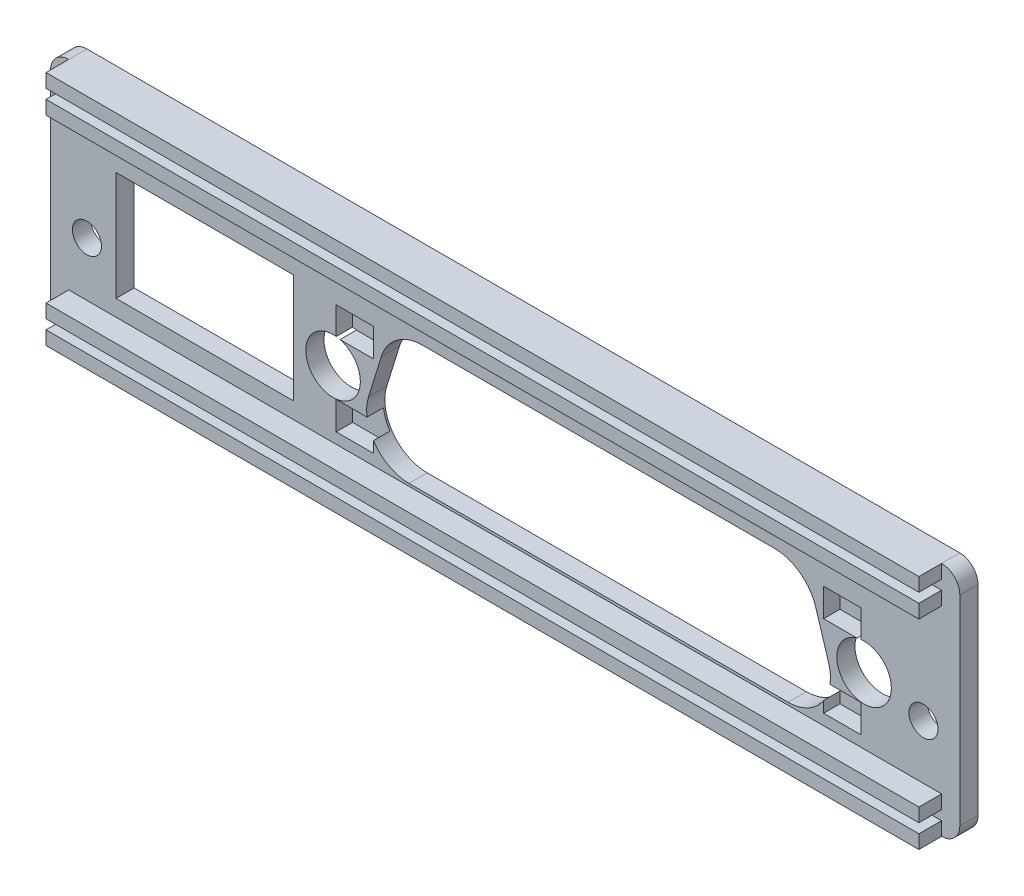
SolidWorks part; units mm, degrees
other "Markup1"
sketch "Sketch35" plane through (-52.5, 13, 44.5) normal (-0.6257, 0.1895, 0.7567) x (0.7782, 0.0858, 0.6221)
ref_plane "Front Plane" through (0, 0, 0) normal (0, 0, 1) x (1, 0, 0)
ref_plane "Top Plane" through (0, 0, 0) normal (0, 1, 0) x (1, 0, 0)
ref_plane "Right Plane" through (0, 0, 0) normal (1, 0, 0) x (0, 0, -1)
sketch "Sketch1" plane through (0, 0, 0) normal (0, 0, 1) x (1, 0, 0)
  line L1 (-56.25, -12.1) -> (56.25, -12.1)
  line L2 (-56.25, -12.1) -> (-56.25, 12.1)
  line L3 (-56.25, 12.1) -> (56.25, 12.1)
  line L4 (56.25, -12.1) -> (56.25, 12.1)
  line L5 (-56.25, -12.1) -> (56.25, 12.1) construction
  line L6 (-56.25, 12.1) -> (56.25, -12.1) construction
  point P0 (0, 0)
  dimension "D1" = 112.5
  dimension "D2" = 24.2
extrude "Boss-Extrude1" add sketch "Sketch1" along normal blind 4.5
sketch "Sketch2" plane through (0, 0, 4.5) normal (0, 0, 1) x (1, 0, 0)
  line L0 (35.0828, -2.7809) -> (33.6783, 1.7487) construction
  line L1 (29.619, 4.74) -> (-9.081, 4.74) construction
  line L2 (-10.581, -8.16) -> (31.119, -8.16) construction
  line L3 (-13.1403, 1.7487) -> (-14.5448, -2.7809) construction
  line L4 (35.0828, -2.7809) -> (33.6783, 1.7487) construction
  line L5 (29.619, 4.74) -> (-9.081, 4.74) construction
  line L6 (-10.581, -8.16) -> (31.119, -8.16) construction
  line L7 (-13.1403, 1.7487) -> (-14.5448, -2.7809) construction
  line L8 (35.5604, -2.6329) -> (34.1559, 1.8968)
  line L9 (29.619, 5.24) -> (-9.081, 5.24)
  line L10 (-13.6179, 1.8967) -> (-15.0224, -2.6329)
  line L11 (-10.581, -8.66) -> (31.119, -8.66)
  line L12 (-46.627, -7.16) -> (-24.123, -7.16) construction
  line L13 (-23.3, -7.16) -> (-42.8, -7.16)
  line L14 (-23.3, -7.16) -> (-23.3, 4.84)
  line L15 (-23.3, 4.84) -> (-42.8, 4.84)
  line L16 (-42.8, -7.16) -> (-42.8, 4.84)
  line L17 (-23.3, -7.16) -> (-42.8, 4.84) construction
  line L18 (-23.3, 4.84) -> (-42.8, -7.16) construction
  line L21 (-20.5706, -1.7692) -> (-10.531, -1.7692) construction
  line L22 (-46.5, 7.7015) -> (-46.5, 7.29) construction
  line L23 (-10.531, 0.44) -> (-10.531, -3.86) construction
  line L28 (-17.031, 5.89) -> (-8.531, 5.89) construction
  circle A0 centre (-18.931, -1.66) radius 3
  circle A1 centre (39.469, -1.66) radius 3
  spline S0 degree 3 poles (31.119, -8.16) (34.175, -8.16) (35.9879, -5.6998) (35.0828, -2.7809) knots 0 0 0 0 1 1 1 1 weights 1 0.72882 0.72882 1 construction
  spline S1 degree 3 poles (33.6783, 1.7487) (33.1062, 3.5939) (31.5509, 4.74) (29.619, 4.74) knots 0 0 0 0 1 1 1 1 weights 1 0.870022 0.870022 1 construction
  spline S2 degree 3 poles (-9.081, 4.74) (-11.0129, 4.74) (-12.5682, 3.5939) (-13.1403, 1.7487) knots 0 0 0 0 1 1 1 1 weights 1 0.870022 0.870022 1 construction
  spline S3 degree 3 poles (-14.5448, -2.7809) (-15.4499, -5.6998) (-13.637, -8.16) (-10.581, -8.16) knots 0 0 0 0 1 1 1 1 weights 1 0.72882 0.72882 1 construction
  spline S4 degree 3 poles (31.119, -8.16) (34.175, -8.16) (35.9879, -5.6998) (35.0828, -2.7809) knots 0 0 0 0 1 1 1 1 weights 1 0.72882 0.72882 1 construction
  spline S5 degree 3 poles (33.6783, 1.7487) (33.1062, 3.5939) (31.5509, 4.74) (29.619, 4.74) knots 0 0 0 0 1 1 1 1 weights 1 0.870022 0.870022 1 construction
  spline S6 degree 3 poles (-9.081, 4.74) (-11.0129, 4.74) (-12.5682, 3.5939) (-13.1403, 1.7487) knots 0 0 0 0 1 1 1 1 weights 1 0.870022 0.870022 1 construction
  spline S7 degree 3 poles (-14.5448, -2.7809) (-15.4499, -5.6998) (-13.637, -8.16) (-10.581, -8.16) knots 0 0 0 0 1 1 1 1 weights 1 0.72882 0.72882 1 construction
  spline S8 degree 1 poles (34.1559, 1.8968) (29.619, 5.24) knots 0 0 1 1 construction
  spline S9 degree 1 poles (-9.081, 5.24) (-13.6179, 1.8967) knots 0 0 1 1 construction
  spline S10 degree 1 poles (-15.0224, -2.6329) (-10.581, -8.66) knots 0 0 1 1 construction
  spline S11 degree 1 poles (31.119, -8.66) (35.5604, -2.6329) knots 0 0 1 1 construction
  spline S12 degree 3 poles (34.1559, 1.8968) (34.0114, 2.3627) (33.5904, 3.2388) (32.4906, 4.3869) (31.0683, 5.0973) (30.1068, 5.24) (29.619, 5.24) knots 0 0 0 0 0.25 0.5 0.75 1 1 1 1
  spline S13 degree 3 poles (-9.081, 5.24) (-9.5688, 5.24) (-10.5303, 5.0973) (-11.9526, 4.3869) (-13.0524, 3.2387) (-13.4734, 2.3627) (-13.6179, 1.8967) knots 0 0 0 0 0.25 0.5 0.75 1 1 1 1
  spline S14 degree 3 poles (-15.0224, -2.6329) (-15.1192, -2.945) (-15.2465, -3.5703) (-15.2286, -5.0166) (-14.4915, -6.8917) (-12.9189, -8.151) (-11.5427, -8.5964) (-10.9078, -8.66) (-10.581, -8.66) knots 0 0 0 0 0.125 0.25 0.5 0.75 0.875 1 1 1 1
  spline S15 degree 3 poles (31.119, -8.66) (31.4458, -8.66) (32.0807, -8.5964) (33.4569, -8.151) (35.0295, -6.8917) (35.7666, -5.0166) (35.7845, -3.5703) (35.6572, -2.945) (35.5604, -2.6329) knots 0 0 0 0 0.125 0.25 0.5 0.75 0.875 1 1 1 1
  spline S16 degree 3 poles (-18.072, -1.71) (-18.072, 0.79) (-20.572, 0.79) (-20.572, -1.71) (-20.572, -4.21) (-18.072, -4.21) (-18.072, -1.71) (-18.072, 0.79) (-20.572, 0.79) knots -0.5 0 0 0 0.5 0.5 0.5 1 1 1 1.5 1.5 1.5 weights 1 0.333333 0.333333 1 0.333333 0.333333 1 0.333333 0.333333 only from (-18.072, -1.71) to (-18.072, -1.71) construction
  point P16 (-33.05, -1.16)
  point P23 (10.269, -8.66)
  dimension "D5" = 6
  dimension "D6" = 6
  dimension "D2" = 12
  dimension "D3" = 19.5
  dimension "D4" = 3.7
  dimension "D7" = 58.4
  dimension "D8" = 29.2
  dimension "D9" = 29.2
  dimension "D10" = 90
  dimension "D11" = 7.55
  dimension "D1" = 0.5
extrude "Cut-Extrude1" cut sketch "Sketch2" against normal through all
sketch "Sketch3" plane through (0, 0, 4.5) normal (0, 0, 1) x (1, 0, 0)
  line L0 (-16.531, 1.39) -> (-16.531, 4.19) construction
  line L1 (-18.581, 1.24) -> (-14.481, 1.24)
  line L2 (-18.581, 1.24) -> (-18.581, 4.34)
  line L3 (-18.581, 4.34) -> (-14.481, 4.34)
  line L4 (-14.481, 1.24) -> (-14.481, 4.34)
  line L5 (-18.581, 1.24) -> (-14.481, 4.34) construction
  line L6 (-18.581, 4.34) -> (-14.481, 1.24) construction
  line L7 (-16.531, -7.61) -> (-16.531, -4.81) construction
  line L8 (-18.581, -7.76) -> (-14.481, -7.76)
  line L9 (-18.581, -7.76) -> (-18.581, -4.66)
  line L10 (-18.581, -4.66) -> (-14.481, -4.66)
  line L11 (-14.481, -7.76) -> (-14.481, -4.66)
  line L12 (-18.581, -7.76) -> (-14.481, -4.66) construction
  line L13 (-18.581, -4.66) -> (-14.481, -7.76) construction
  line L14 (37.069, 4.19) -> (37.069, 1.39) construction
  line L15 (35.019, 1.24) -> (39.119, 1.24)
  line L16 (35.019, 1.24) -> (35.019, 4.34)
  line L17 (35.019, 4.34) -> (39.119, 4.34)
  line L18 (39.119, 1.24) -> (39.119, 4.34)
  line L19 (35.019, 1.24) -> (39.119, 4.34) construction
  line L20 (35.019, 4.34) -> (39.119, 1.24) construction
  line L21 (37.069, -4.81) -> (37.069, -7.61) construction
  line L22 (35.019, -7.76) -> (39.119, -7.76)
  line L23 (35.019, -7.76) -> (35.019, -4.66)
  line L24 (35.019, -4.66) -> (39.119, -4.66)
  line L25 (39.119, -7.76) -> (39.119, -4.66)
  line L26 (35.019, -7.76) -> (39.119, -4.66) construction
  line L27 (35.019, -4.66) -> (39.119, -7.76) construction
  point P0 (-16.531, 2.79)
  point P7 (-16.531, -6.21)
  point P14 (37.069, 2.79)
  point P21 (37.069, -6.21)
  dimension "D1" = 4.1
  dimension "D2" = 3.1
  dimension "D3" = 4.1
  dimension "D4" = 3.1
  dimension "D5" = 4.1
  dimension "D6" = 3.1
  dimension "D7" = 4.1
  dimension "D8" = 3.1
extrude "Cut-Extrude2" cut sketch "Sketch3" against normal blind 1.8
sketch "Sketch29" plane through (0, 12.1, 0) normal (0, 1, 0) x (1, 0, 0)
  line L4 (56.25, 0) -> (-56.25, 0)
  line L5 (-56.25, 0) -> (-56.25, -4.5)
  line L6 (-56.25, -4.5) -> (56.25, -4.5)
  line L7 (56.25, -4.5) -> (56.25, 0)
  line L8 (56.25, 0) -> (-56.25, 0)
  line L9 (-56.25, 0) -> (-56.25, -4.5)
  line L10 (-56.25, -4.5) -> (56.25, -4.5)
  line L11 (56.25, -4.5) -> (56.25, 0)
  dimension "D1" = 0
extrude "Boss-Extrude2" add sketch "Sketch29" along normal blind 0.9
sketch "Sketch30" plane through (0, -12.1, 0) normal (0, -1, 0) x (1, 0, 0)
  line L4 (-56.25, 0) -> (56.25, 0)
  line L5 (56.25, 0) -> (56.25, 4.5)
  line L6 (56.25, 4.5) -> (-56.25, 4.5)
  line L7 (-56.25, 4.5) -> (-56.25, 0)
  line L8 (-56.25, 0) -> (56.25, 0)
  line L9 (56.25, 0) -> (56.25, 4.5)
  line L10 (56.25, 4.5) -> (-56.25, 4.5)
  line L11 (-56.25, 4.5) -> (-56.25, 0)
  dimension "D1" = 0
extrude "Boss-Extrude3" add sketch "Sketch30" along normal blind 0.9
sketch "Sketch31" plane through (0, 0, 4.5) normal (0, 0, 1) x (1, 0, 0)
  line L0 (-56.25, 11.5) -> (56.25, 11.5) construction
  line L1 (-56.25, 13) -> (-56.25, -13) construction
  line L2 (56.25, -13) -> (56.25, 13) construction
  line L3 (-56.25, 13) -> (56.25, 13) construction
  line L4 (-56.25, -11.5) -> (56.25, -11.5) construction
  line L5 (56.25, -13) -> (-56.25, -13) construction
  line L6 (0, 0) -> (0, -13) construction
  line L7 (-53.25, -11.5) -> (53.25, -11.5)
  line L8 (-53.25, -11.5) -> (-53.25, -10.45)
  line L9 (-53.25, -10.45) -> (53.25, -10.45)
  line L10 (53.25, -11.5) -> (53.25, -10.45)
  line L11 (-53.25, -11.5) -> (53.25, -10.45) construction
  line L12 (-53.25, -10.45) -> (53.25, -11.5) construction
  line L13 (0, 0) -> (0, 13) construction
  line L14 (-53.25, 10.45) -> (53.25, 10.45)
  line L15 (-53.25, 10.45) -> (-53.25, 11.5)
  line L16 (-53.25, 11.5) -> (53.25, 11.5)
  line L17 (53.25, 10.45) -> (53.25, 11.5)
  line L18 (-53.25, 10.45) -> (53.25, 11.5) construction
  line L19 (-53.25, 11.5) -> (53.25, 10.45) construction
  point P12 (0, -10.975)
  point P21 (0, 10.975)
  dimension "D1" = 1.5
  dimension "D2" = 1.5
  dimension "D3" = 1.05
  dimension "D4" = 106.5
  dimension "D5" = 1.05
  dimension "D6" = 106.5
extrude "Cut-Extrude21" cut sketch "Sketch31" against normal blind 2.5
sketch "Sketch32" plane through (56.25, 0, 0) normal (1, 0, 0) x (0, 0, -1)
  line L4 (0, -13) -> (0, 13)
  line L5 (0, 13) -> (-4.5, 13)
  line L6 (-4.5, 13) -> (-4.5, -13)
  line L7 (-4.5, -13) -> (0, -13)
  line L8 (0, -13) -> (0, 13)
  line L9 (0, 13) -> (-4.5, 13)
  line L10 (-4.5, 13) -> (-4.5, -13)
  line L11 (-4.5, -13) -> (0, -13)
  dimension "D1" = 0
extrude "Cut-Extrude22" cut sketch "Sketch32" against normal blind 2.5
sketch "Sketch33" plane through (-56.25, 0, 0) normal (-1, 0, 0) x (0, 0, 1)
  line L4 (0, 13) -> (0, -13)
  line L5 (0, -13) -> (4.5, -13)
  line L6 (4.5, -13) -> (4.5, 13)
  line L7 (4.5, 13) -> (0, 13)
  line L8 (0, 13) -> (0, -13)
  line L9 (0, -13) -> (4.5, -13)
  line L10 (4.5, -13) -> (4.5, 13)
  line L11 (4.5, 13) -> (0, 13)
  dimension "D1" = 0
extrude "Cut-Extrude23" cut sketch "Sketch33" against normal blind 2.5
sketch "Sketch34" plane through (0, 0, 4.5) normal (0, 0, 1) x (1, 0, 0)
  line L0 (53.75, 13) -> (53.75, -13)
  line L1 (53.75, -13) -> (51.25, -13)
  line L2 (53.75, -13) -> (-53.75, -13) construction
  line L3 (51.25, -13) -> (51.25, 13)
  line L4 (-53.75, 13) -> (53.75, 13) construction
  line L5 (51.25, 13) -> (53.75, 13)
  line L6 (-53.75, 13) -> (-51.25, 13)
  line L7 (-51.25, 13) -> (-51.25, -13)
  line L8 (-51.25, -13) -> (-53.75, -13)
  line L9 (-53.75, -13) -> (-53.75, 13)
  dimension "D1" = 2.5
  dimension "D2" = 2.5
extrude "Boss-Extrude4" add sketch "Sketch34" along normal blind 40 and the other way up to surface
sketch "Sketch36" plane through (0, 13, 0) normal (0, 1, 0) x (1, 0, 0)
  line L0 (-51.25, -4.5) -> (-51.25, 0)
  line L1 (51.25, -4.5) -> (51.25, 0)
  line L2 (-51.25, 0) -> (-53.75, 0)
  line L8 (53.75, 0) -> (-53.75, 0)
  line L9 (-53.75, 0) -> (-53.75, -44.5)
  line L10 (-53.75, -44.5) -> (-51.25, -44.5)
  line L11 (-51.25, -44.5) -> (-51.25, -4.5)
  line L12 (-51.25, -4.5) -> (51.25, -4.5)
  line L13 (51.25, -4.5) -> (51.25, -44.5)
  line L14 (51.25, -44.5) -> (53.75, -44.5)
  line L15 (53.75, -44.5) -> (53.75, 0)
  line L16 (53.75, 0) -> (51.25, 0)
  line L17 (-53.75, 0) -> (-53.75, -44.5)
  line L18 (-53.75, -44.5) -> (-51.25, -44.5)
  line L19 (-51.25, -44.5) -> (-51.25, -4.5)
  line L21 (51.25, -4.5) -> (51.25, -44.5)
  line L22 (51.25, -44.5) -> (53.75, -44.5)
  line L23 (53.75, -44.5) -> (53.75, 0)
  dimension "D1" = 0
extrude "Cut-Extrude24" cut sketch "Sketch36" against normal through all
sketch "Sketch37" plane through (-51.25, 0, 0) normal (-1, 0, 0) x (0, 0, 1)
  line L0 (0, 0) -> (4.5, 0) construction
  line L1 (4.5, 10.45) -> (4.5, -10.45) construction
  line L3 (0, -13) -> (4.5, -13)
  line L4 (0, -13) -> (0, 13)
  line L5 (0, 13) -> (4.5, 13)
  line L6 (4.5, -13) -> (4.5, 13)
  line L7 (0, -13) -> (4.5, 13) construction
  line L8 (0, 13) -> (4.5, -13) construction
  point P5 (2.25, 0)
extrude "Cut-Extrude25" cut sketch "Sketch37" against normal blind 1.25
mirror "Mirror1" about plane through (0, 0, 0) normal (1, 0, 0) of "Cut-Extrude25"
sketch "Sketch38" plane through (-50, 0, 0) normal (-1, 0, 0) x (0, 0, 1)
  line L0 (2, 11.5) -> (2, 10.45)
  line L1 (2, 10.45) -> (4.5, 10.45)
  line L2 (4.5, 10.45) -> (4.5, 11.5)
  line L3 (4.5, 11.5) -> (2, 11.5)
  line L4 (2, -10.45) -> (2, -11.5)
  line L5 (2, -11.5) -> (4.5, -11.5)
  line L6 (4.5, -11.5) -> (4.5, -10.45)
  line L7 (4.5, -10.45) -> (2, -10.45)
extrude "Boss-Extrude5" add sketch "Sketch38" against normal blind 1.75
mirror "Mirror2" about plane through (0, 0, 0) normal (1, 0, 0) of "Boss-Extrude5"
sketch "Sketch39" plane through (0, 0, 0) normal (0, 0, -1) x (-1, 0, 0)
  circle A0 centre (-46, -3) radius 1.6
  circle A1 centre (46, -3) radius 1.6
  dimension "D1" = 3.2
  dimension "D2" = 3.2
extrude "Cut-Extrude26" cut sketch "Sketch39" against normal through all
sketch "Sketch41" plane through (0, 0, 4.5) normal (0, 0, 1) x (1, 0, 0)
  line L0 (48.25, 11.5) -> (-48.25, 11.5) construction
  line L1 (-48, 11.5) -> (48, 11.5)
  line L2 (-48, 11.5) -> (-48, 13)
  line L3 (-48, 13) -> (48, 13)
  line L4 (48, 11.5) -> (48, 13)
  line L5 (-48, 11.5) -> (48, 13) construction
  line L6 (-48, 13) -> (48, 11.5) construction
  line L7 (0, 0) -> (0, 13) construction
  line L8 (-50, 13) -> (50, 13) construction
  line L9 (-48.25, 10.975) -> (48.25, 10.975) construction
  line L10 (-48.25, 11.5) -> (-48.25, 10.45) construction
  line L11 (48.25, 11.5) -> (48.25, 10.45) construction
  line L12 (-48, 8.95) -> (48, 8.95)
  line L13 (48, 10.45) -> (48, 8.95)
  line L14 (-48, 10.45) -> (48, 10.45)
  line L15 (-48, 10.45) -> (-48, 8.95)
  point P0 (0, 12.25)
  dimension "D1" = 96
  dimension "D2" = 1.5
extrude "Boss-Extrude6" add sketch "Sketch41" along normal blind 2.5
mirror "Mirror3" about plane through (0, 0, 0) normal (0, 1, 0) of "Boss-Extrude6"
fillet "Fillet1" radius 2 8 edges at (50, -13, 2.25) (49, -13, 4.5) (-49, -13, 4.5) (-50, -13, 2.25) (50, 13, 2.25) (-50, 13, 2.25) (-49, 13, 4.5) (49, 13, 4.5)
sketch "Sketch42" plane through (0, 0, 0) normal (0, 0, -1) x (-1, 0, 0)
  line L4 (-50, 11) -> (-50, -11)
  line L5 (-48, -13) -> (48, -13)
  line L6 (50, -11) -> (50, 11)
  line L7 (48, 13) -> (-48, 13)
  line L8 (-50, 11) -> (-50, -11)
  line L9 (-48, -13) -> (48, -13)
  line L10 (50, -11) -> (50, 11)
  line L11 (48, 13) -> (-48, 13)
  arc A4 (-50, -11) -> (-48, -13) centre (-48, -11) ccw
  arc A5 (48, -13) -> (50, -11) centre (48, -11) ccw
  arc A6 (50, 11) -> (48, 13) centre (48, 11) ccw
  arc A7 (-48, 13) -> (-50, 11) centre (-48, 11) ccw
  arc A8 (-50, -11) -> (-48, -13) centre (-48, -11) ccw
  arc A9 (48, -13) -> (50, -11) centre (48, -11) ccw
  arc A10 (50, 11) -> (48, 13) centre (48, 11) ccw
  arc A11 (-48, 13) -> (-50, 11) centre (-48, 11) ccw
  dimension "D1" = 0
extrude "Cut-Extrude28" cut sketch "Sketch42" against normal blind 2.5
sketch "Sketch43" plane through (0, 10.45, 0) normal (0, 1, 0) x (1, 0, 0)
  line L0 (48.25, -4.5) -> (48.25, -2.5)
  line L1 (48.25, -2.5) -> (-48.25, -2.5)
  line L2 (-48.25, -2.5) -> (-48.25, -4.5)
  line L3 (-48.25, -4.5) -> (48.25, -4.5)
extrude "Boss-Extrude7" add sketch "Sketch43" along normal up to surface (1.05 mm away)
sketch "Sketch47" plane through (0, -10.45, 0) normal (0, -1, 0) x (1, 0, 0)
  line L0 (-48.25, 2.5) -> (-48.25, 4.5)
  line L1 (-48.25, 4.5) -> (48.25, 4.5)
  line L2 (48.25, 4.5) -> (48.25, 2.5)
  line L3 (48.25, 2.5) -> (-48.25, 2.5)
extrude "Boss-Extrude8" add sketch "Sketch47" along normal up to surface (1.05 mm away)
